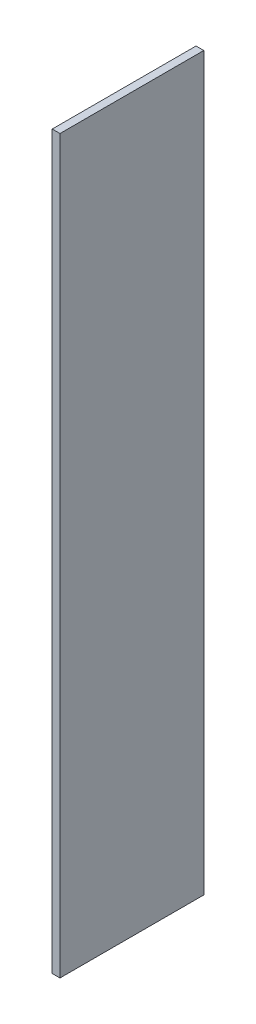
SolidWorks part; units mm, degrees
ref_plane "Front Plane" through (0, 0, 0) normal (0, 0, 1) x (1, 0, 0)
ref_plane "Top Plane" through (0, 0, 0) normal (0, 1, 0) x (1, 0, 0)
ref_plane "Right Plane" through (0, 0, 0) normal (1, 0, 0) x (0, 0, -1)
sketch "Sketch1" plane through (0, 0, 0) normal (1, 0, 0) x (0, 0, -1)
  line L1 (-28.2194, 143.51) -> (28.2194, 143.51)
  line L2 (-28.2194, 143.51) -> (-28.2194, -143.51)
  line L3 (-28.2194, -143.51) -> (28.2194, -143.51)
  line L4 (28.2194, 143.51) -> (28.2194, -143.51)
  line L5 (-28.2194, 143.51) -> (28.2194, -143.51) construction
  line L6 (-28.2194, -143.51) -> (28.2194, 143.51) construction
  point P0 (0, 0)
extrude "Boss-Extrude1" add sketch "Sketch1" along normal blind 3.048
equation "\"motor offset\"=6mm"
equation "\"thickness0.25\"=0.225in"
equation "\"thickness0.125\"=0.122in"
equation "\"thickness_acrylic0.1\"= 0.1in"
equation "\"D1@Sketch1\"=\"thickness_acrylic0.1\"+\"thickness0.125\"+2"
